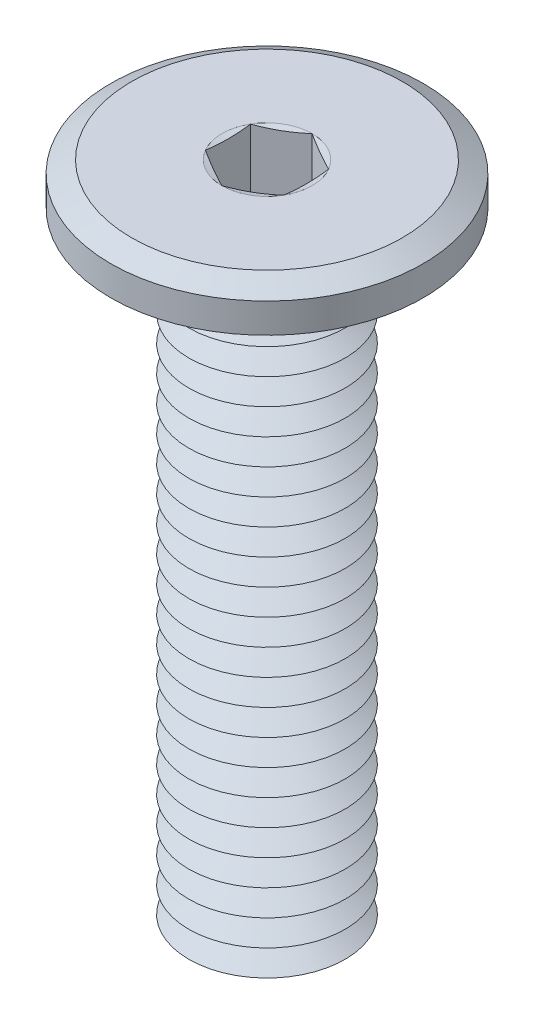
SolidWorks part; units mm, degrees
ref_plane "Front Plane" through (0, 0, 0) normal (0, 0, 1) x (1, 0, 0)
ref_plane "Top Plane" through (0, 0, 0) normal (0, 1, 0) x (1, 0, 0)
ref_plane "Right Plane" through (0, 0, 0) normal (1, 0, 0) x (0, 0, -1)
sketch "Sketch1" plane through (0, 0, 0) normal (0, 1, 0) x (1, 0, 0)
  circle A0 centre (0, 0) radius 3
  dimension "D1" = 6
extrude "Boss-Extrude1" add sketch "Sketch1" against normal blind 0.8
sketch "Sketch2" plane through (0, -0.8, 0) normal (0, -1, 0) x (1, 0, 0)
  circle A0 centre (0, 0) radius 1.5
  dimension "D1" = 3
extrude "Boss-Extrude2" add sketch "Sketch2" along normal blind 12
sketch "Sketch3" plane through (0, 0, 0) normal (1, 0, 0) x (0, 0, -1)
  line L0 (0, 0.9906) -> (0, -8.2999) construction
sketch "Sketch5" plane through (0, 0, 0) normal (1, 0, 0) x (0, 0, -1)
  line L0 (-1.5, -13.05) -> (-1.067, -12.8)
  line L1 (-1.5, -0.8) -> (-1.5, -12.8) construction
  line L2 (-1.067, -12.8) -> (-1.5, -12.55)
  line L3 (-1.5, -0.8) -> (-1.5, -12.8) construction
  line L4 (-1.5, -12.55) -> (-1.5, -13.05)
  line L6 (-1.5, -0.8) -> (-1.5, -12.8) construction
  line L7 (-1.5, -0.8) -> (-1.5, -12.8) construction
  line L14 (-1.5, -12.8) -> (1.5, -12.8) construction
  dimension "D1" = 0.5
revolve "Cut-Revolve1" cut sketch "Sketch5" angle 360 about L0
pattern_linear "LPattern1" count 23 spacing 0.5 along (0, 1, 0) of "Cut-Revolve1"
fillet "Fillet1" radius 0.1 1 edges at (0, -0.8, -1.5)
chamfer "Chamfer2" distance 0.4 angle 30 1 edges at (0, 0, 3)
sketch "Sketch6" plane through (0, 0, 0) normal (0, 1, 0) x (1, 0, 0)
  line L1 (0, 0.866) -> (-0.75, 0.433)
  line L2 (-0.75, 0.433) -> (-0.75, -0.433)
  line L3 (-0.75, -0.433) -> (0, -0.866)
  line L4 (0, -0.866) -> (0.75, -0.433)
  line L5 (0.75, -0.433) -> (0.75, 0.433)
  line L6 (0.75, 0.433) -> (0, 0.866)
  circle A0 centre (0, 0) radius 0.75 construction
  dimension "D1" = 1.5
extrude "Cut-Extrude1" cut sketch "Sketch6" against normal blind 1.4
sketch "Sketch7" plane through (0, -1.4, 0) normal (0, 1, 0) x (1, 0, 0)
  line L0 (-0.75, 0.433) -> (-0.75, -0.433) construction
  circle A0 centre (0, 0) radius 0.75
extrude "Cut-Extrude2" cut sketch "Sketch7" against normal through all draft 60
sketch "Sketch8" plane through (0, 0, 0) normal (0, 1, 0) x (1, 0, 0)
  circle A0 centre (0, 0) radius 0.866
extrude "Cut-Extrude3" cut sketch "Sketch8" against normal through all draft 75
